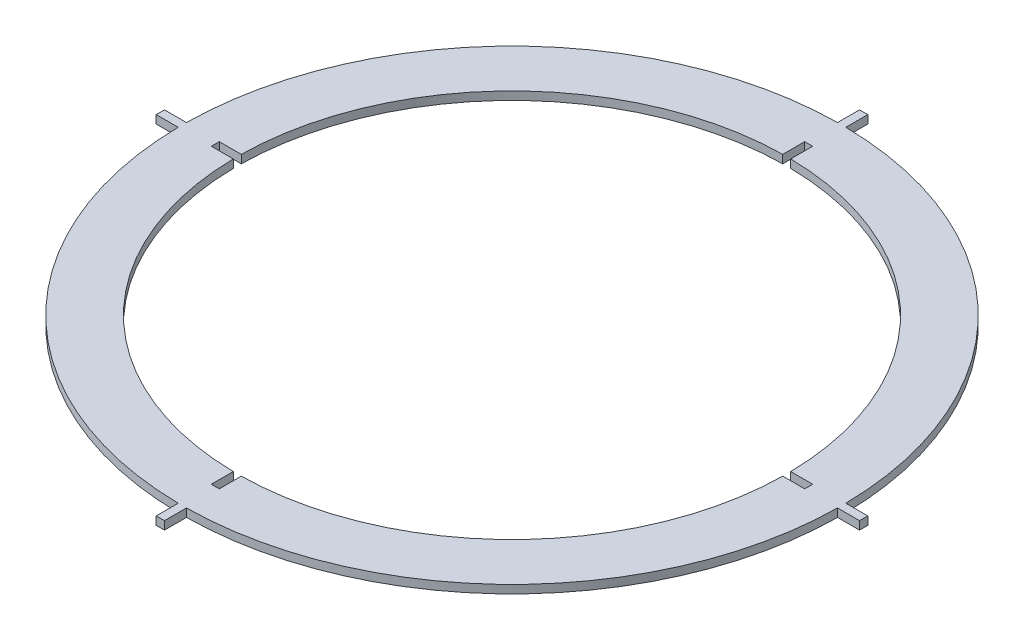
SolidWorks part; units mm, degrees
ref_plane "Front Plane" through (0, 0, 0) normal (0, 0, 1) x (1, 0, 0)
ref_plane "Top Plane" through (0, 0, 0) normal (0, 1, 0) x (1, 0, 0)
ref_plane "Right Plane" through (0, 0, 0) normal (1, 0, 0) x (0, 0, -1)
sketch "Sketch1" plane through (0, 0, 0) normal (0, 1, 0) x (1, 0, 0)
  line L0 (0, 0) -> (-29.8607, 0) construction
  line L1 (2.3553, 0) -> (0, 0) construction
  line L2 (0, 0) -> (0, -23.9022) construction
  line L3 (1.45, 87.9869) -> (1.45, 79.9869)
  line L4 (-147.992, 1.5) -> (-139.992, 1.5)
  line L5 (-147.992, 1.5) -> (-147.992, -1.5)
  line L6 (-147.992, -1.5) -> (-139.992, -1.5)
  line L7 (-1.45, 87.9869) -> (-1.45, 79.9869)
  line L8 (-127.9906, -1.5) -> (-119.9906, -1.5)
  line L9 (-127.9906, -1.5) -> (-127.9906, 1.5)
  line L10 (-127.9906, 1.5) -> (-119.9906, 1.5)
  line L11 (-1.45, 87.9869) -> (1.45, 87.9869)
  line L12 (-107.9895, -1.45) -> (-99.9895, -1.45)
  line L13 (-107.9895, -1.45) -> (-107.9895, 1.45)
  line L14 (-107.9895, 1.45) -> (-99.9895, 1.45)
  line L15 (-1.45, 107.9895) -> (-1.45, 99.9895)
  line L16 (-87.9869, -1.45) -> (-79.9869, -1.45)
  line L17 (-87.9869, -1.45) -> (-87.9869, 1.45)
  line L18 (-87.9869, 1.45) -> (-79.9869, 1.45)
  line L19 (1.45, 107.9895) -> (1.45, 99.9895)
  line L20 (-1.45, 107.9895) -> (1.45, 107.9895)
  line L21 (1.5, 127.9906) -> (1.5, 119.9906)
  line L22 (-1.5, 127.9906) -> (-1.5, 119.9906)
  line L23 (-1.5, 127.9906) -> (1.5, 127.9906)
  line L24 (1.5, 147.992) -> (1.5, 139.992)
  line L25 (-1.5, 147.992) -> (-1.5, 139.992)
  line L26 (87.9869, -1.45) -> (79.9869, -1.45)
  line L27 (87.9869, 1.45) -> (79.9869, 1.45)
  line L28 (87.9869, 1.45) -> (87.9869, -1.45)
  line L29 (107.9895, 1.45) -> (99.9895, 1.45)
  line L30 (107.9895, -1.45) -> (99.9895, -1.45)
  line L31 (107.9895, 1.45) -> (107.9895, -1.45)
  line L32 (127.9906, -1.5) -> (119.9906, -1.5)
  line L33 (127.9906, 1.5) -> (119.9906, 1.5)
  line L34 (127.9906, 1.5) -> (127.9906, -1.5)
  line L35 (147.992, -1.5) -> (139.992, -1.5)
  line L36 (147.992, 1.5) -> (139.992, 1.5)
  line L37 (-1.45, -87.9869) -> (-1.45, -79.9869)
  line L38 (1.45, -87.9869) -> (1.45, -79.9869)
  line L39 (1.45, -87.9869) -> (-1.45, -87.9869)
  line L40 (1.45, -107.9895) -> (1.45, -99.9895)
  line L41 (-1.45, -107.9895) -> (-1.45, -99.9895)
  line L42 (1.45, -107.9895) -> (-1.45, -107.9895)
  line L43 (-1.5, -127.9906) -> (-1.5, -119.9906)
  line L44 (1.5, -127.9906) -> (1.5, -119.9906)
  line L45 (1.5, -127.9906) -> (-1.5, -127.9906)
  line L46 (-1.5, -147.992) -> (-1.5, -139.992)
  line L47 (1.5, -147.992) -> (1.5, -139.992)
  line L48 (1.45, 87.9869) -> (1.45, 79.9869)
  line L49 (-1.45, 87.9869) -> (-1.45, 79.9869)
  line L50 (-1.45, 87.9869) -> (1.45, 87.9869)
  line L51 (-1.45, 107.9895) -> (-1.45, 99.9895)
  line L52 (1.45, 107.9895) -> (1.45, 99.9895)
  line L53 (-1.45, 107.9895) -> (1.45, 107.9895)
  line L54 (1.5, 127.9906) -> (1.5, 119.9906)
  line L55 (-1.5, 127.9906) -> (-1.5, 119.9906)
  line L56 (-1.5, 127.9906) -> (1.5, 127.9906)
  line L57 (1.5, 147.992) -> (1.5, 139.992)
  line L58 (-1.5, 147.992) -> (-1.5, 139.992)
  line L59 (1.5, 147.992) -> (-1.5, 147.992)
  line L60 (87.9869, -1.45) -> (79.9869, -1.45)
  line L61 (87.9869, 1.45) -> (79.9869, 1.45)
  line L62 (87.9869, 1.45) -> (87.9869, -1.45)
  line L63 (107.9895, 1.45) -> (99.9895, 1.45)
  line L64 (107.9895, -1.45) -> (99.9895, -1.45)
  line L65 (107.9895, 1.45) -> (107.9895, -1.45)
  line L66 (127.9906, -1.5) -> (119.9906, -1.5)
  line L67 (127.9906, 1.5) -> (119.9906, 1.5)
  line L68 (127.9906, 1.5) -> (127.9906, -1.5)
  line L69 (147.992, -1.5) -> (139.992, -1.5)
  line L70 (147.992, 1.5) -> (139.992, 1.5)
  line L71 (147.992, -1.5) -> (147.992, 1.5)
  line L72 (-1.45, -87.9869) -> (-1.45, -79.9869)
  line L73 (1.45, -87.9869) -> (1.45, -79.9869)
  line L74 (1.45, -87.9869) -> (-1.45, -87.9869)
  line L75 (1.45, -107.9895) -> (1.45, -99.9895)
  line L76 (-1.45, -107.9895) -> (-1.45, -99.9895)
  line L77 (1.45, -107.9895) -> (-1.45, -107.9895)
  line L78 (-1.5, -127.9906) -> (-1.5, -119.9906)
  line L79 (1.5, -127.9906) -> (1.5, -119.9906)
  line L80 (1.5, -127.9906) -> (-1.5, -127.9906)
  line L81 (-1.5, -147.992) -> (-1.5, -139.992)
  line L82 (1.5, -147.992) -> (1.5, -139.992)
  line L83 (-1.5, -147.992) -> (1.5, -147.992)
  arc A0 (-79.9869, -1.45) -> (-1.45, -79.9869) centre (0, 0) ccw
  arc A1 (-99.9895, -1.45) -> (-1.45, -99.9895) centre (0, 0) ccw
  arc A2 (-119.9906, -1.5) -> (-1.5, -119.9906) centre (0, 0) ccw
  arc A3 (-139.992, -1.5) -> (-1.5, -139.992) centre (0, 0) ccw
  arc A4 (1.5, -139.992) -> (139.992, -1.5) centre (0, 0) ccw
  arc A5 (1.5, -119.9906) -> (119.9906, -1.5) centre (0, 0) ccw
  arc A6 (1.45, -79.9869) -> (79.9869, -1.45) centre (0, 0) ccw
  arc A7 (1.45, -99.9895) -> (99.9895, -1.45) centre (0, 0) ccw
  arc A8 (-1.45, 79.9869) -> (-79.9869, 1.45) centre (0, 0) ccw
  arc A9 (-1.45, 99.9895) -> (-99.9895, 1.45) centre (0, 0) ccw
  arc A10 (-1.5, 119.9906) -> (-119.9906, 1.5) centre (0, 0) ccw
  arc A11 (-1.5, 139.992) -> (-139.992, 1.5) centre (0, 0) ccw
  arc A12 (79.9869, 1.45) -> (1.45, 79.9869) centre (0, 0) ccw
  arc A13 (99.9895, 1.45) -> (1.45, 99.9895) centre (0, 0) ccw
  arc A14 (119.9906, 1.5) -> (1.5, 119.9906) centre (0, 0) ccw
  arc A15 (139.992, 1.5) -> (1.5, 139.992) centre (0, 0) ccw
  point P71 (0, 0)
  point P97 (0, 0)
  point P146 (0, 0)
  dimension "D1" = 280
  dimension "D4" = 160
  dimension "D5" = 3
  dimension "D6" = 8
  dimension "D3" = 200
  dimension "D2" = 240
  dimension "D8" = 4
  dimension "D7" = 4
  dimension "D9" = 2.9
extrude "Boss-Extrude1" add sketch "Sketch1" along normal blind 3 contours L33 A14 L21 L23 L22 A10 L10 L9 L8 A2 L43 L45 L44 A5 L32 L34 A13 L29 L31 L30 A7 L40 L42 L41 A1 L12 L13 L14 A9 L15 L20 L19
